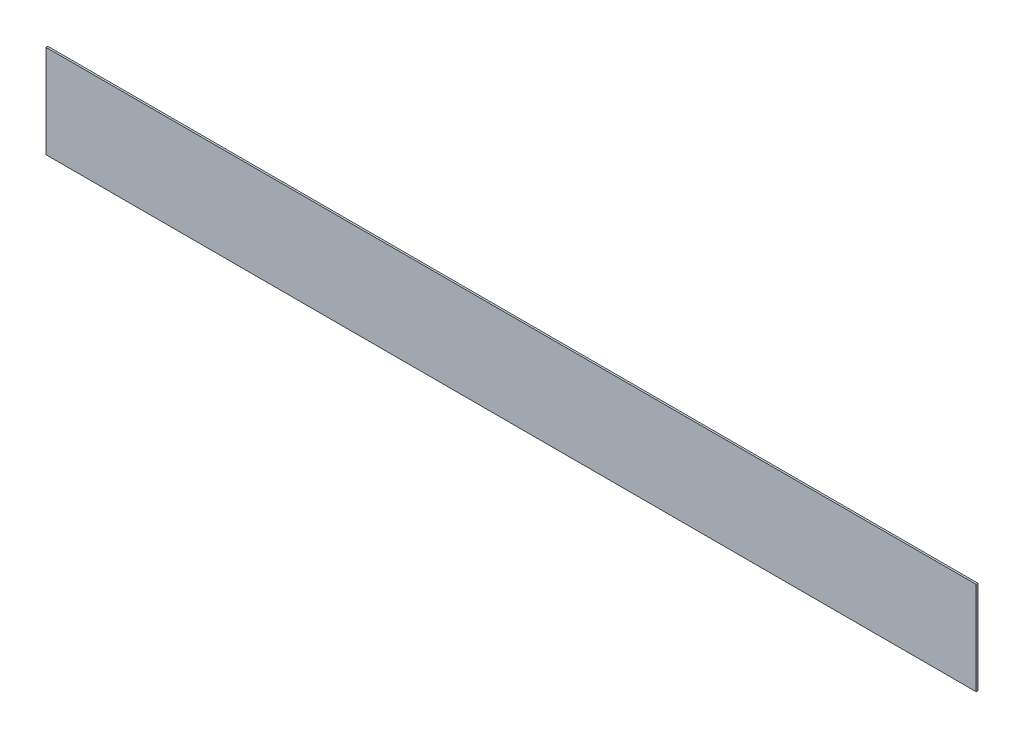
SolidWorks part; units mm, degrees
ref_plane "Plan de face" through (0, 0, 0) normal (0, 0, 1) x (1, 0, 0)
ref_plane "Plan de dessus" through (0, 0, 0) normal (0, 1, 0) x (1, 0, 0)
ref_plane "Plan de droite" through (0, 0, 0) normal (1, 0, 0) x (0, 0, -1)
sketch "Esquisse1" plane through (0, 0, 0) normal (0, 0, 1) x (1, 0, 0)
  line L1 (0, 0) -> (5000, 0)
  line L2 (0, 0) -> (0, 500)
  line L3 (0, 500) -> (5000, 500)
  line L4 (5000, 0) -> (5000, 500)
  dimension "D1" = 5000
  dimension "D2" = 500
extrude "Boss.-Extru.1" add sketch "Esquisse1" along normal blind 10
